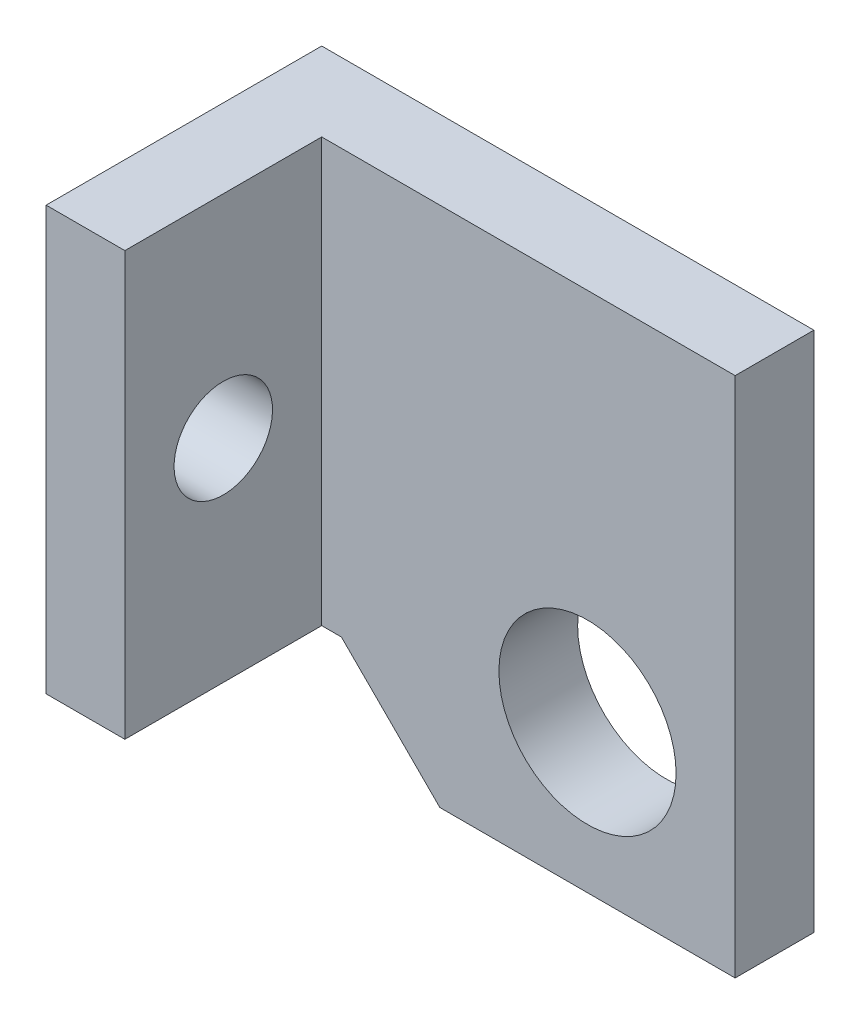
SolidWorks part; units mm, degrees
ref_plane "Face" through (0, 0, 0) normal (0, 0, 1) x (1, 0, 0)
ref_plane "Dessus" through (0, 0, 0) normal (0, 1, 0) x (1, 0, 0)
ref_plane "Droite" through (0, 0, 0) normal (1, 0, 0) x (0, 0, -1)
sketch "Esquisse1" plane through (0, 0, 0) normal (0, 0, 1) x (1, 0, 0)
  line L0 (-35, 38) -> (-35, -5)
  line L1 (-25, -5) -> (-15, -15)
  line L2 (-15, -15) -> (15, -15)
  line L3 (15, -15) -> (15, 38)
  line L4 (15, 38) -> (-35, 38)
  line L5 (-35, -5) -> (-25, -5)
  circle A0 centre (0, 0) radius 9
  dimension "D6" = 18
  dimension "D1" = 35
  dimension "D2" = 38
  dimension "D3" = 5
  dimension "D4" = 10
  dimension "D5" = 45
  dimension "D7" = 15
  dimension "D8" = 15
extrude "Extrusion1" add sketch "Esquisse1" along normal blind 8
sketch "Esquisse2" plane through (0, 0, 8) normal (0, 0, 1) x (1, 0, 0)
  line L0 (-35, -5) -> (-25, -5) construction
  line L1 (-35, 38) -> (-27, 38)
  line L2 (-35, 38) -> (-35, -5)
  line L3 (-35, -5) -> (-27, -5)
  line L4 (-27, 38) -> (-27, -5)
  dimension "D1" = 8
extrude "Extrusion2" add sketch "Esquisse2" along normal blind 20
sketch "Esquisse3" plane through (-27, 0, 0) normal (1, 0, 0) x (0, 0, -1)
  circle A0 centre (-18, 16.5) radius 5
  dimension "D1" = 10
  dimension "D2" = 18
  dimension "D3" = 16.5
extrude "Enlèv. mat.-Extru.1" cut sketch "Esquisse3" against normal up to next
